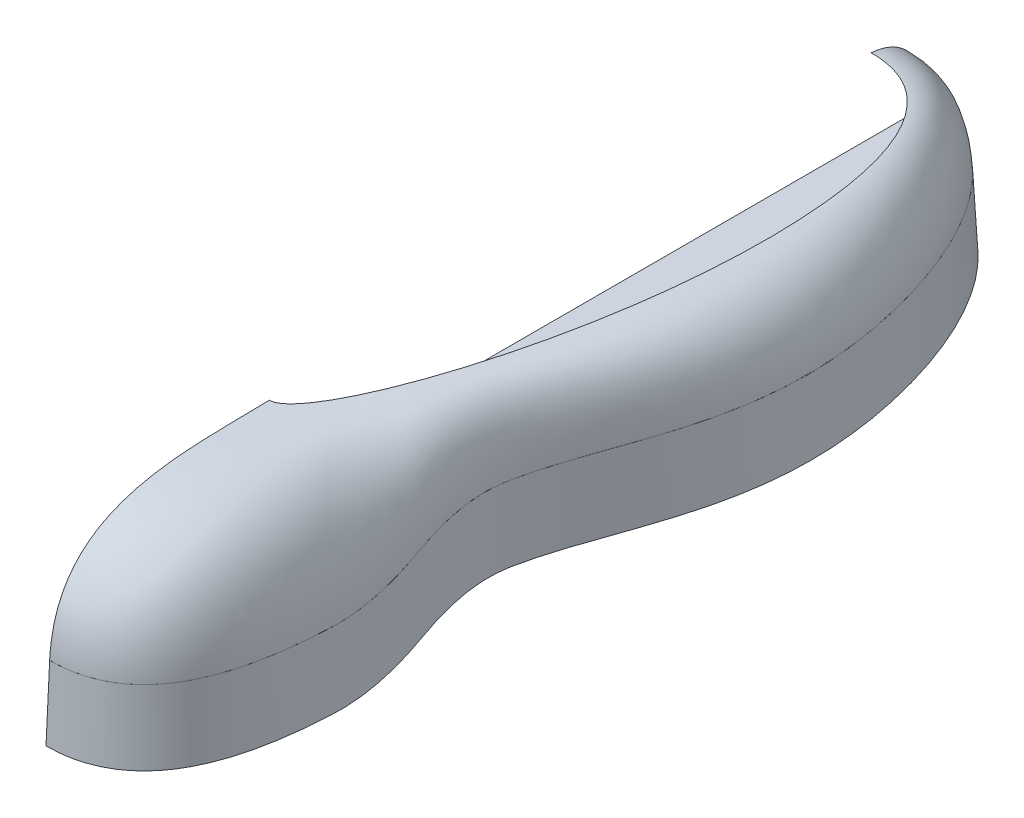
SolidWorks part; units mm, degrees
ref_plane "Front Plane" through (0, 0, 0) normal (0, 0, 1) x (1, 0, 0)
ref_plane "Top Plane" through (0, 0, 0) normal (0, 1, 0) x (1, 0, 0)
ref_plane "Right Plane" through (0, 0, 0) normal (1, 0, 0) x (0, 0, -1)
sketch "Side View Sketch" plane through (0, 0, 0) normal (1, 0, 0) x (0, 0, -1)
  line L0 (-76, 0) -> (70, 0)
  dimension "D1" = 146
  dimension "D2" = 70
sketch "Top View Sketch"
sketch "Side Parting Line" plane through (0, 0, 0) normal (1, 0, 0) x (0, 0, -1)
  line L0 (-76, 0) -> (70, 0) construction
  line L1 (-19, 0) -> (82.163, 0) construction
  line L2 (-48.1033, -7) -> (-94.2513, -7) construction
  arc A0 (-19, 0) -> (-33.5516, -3.5) centre (-19, -32) ccw construction
  arc A1 (-33.5516, -3.5) -> (-48.1033, -7) centre (-48.1033, 25) cw construction
  spline S0 degree 3 poles (-94.2513, -7) (-78.8686, -7) (-63.0665, -7) (-46.8451, -7) (-45.5867, -6.9092) (-44.7519, -6.8268) (-44.3354, -6.7774) (-41.8293, -6.4803) (-39.3757, -5.8901) (-37.0086, -5.0151) (-36.2219, -4.7243) (-34.6713, -4.0809) (-32.432, -2.9191) (-30.8814, -2.2757) (-30.0947, -1.9849) (-27.7276, -1.1099) (-25.2739, -0.5197) (-22.7679, -0.2226) (-22.3514, -0.1732) (-21.5165, -0.0908) (-20.2581, 0) (14.3016, 0) (48.442, 0) (82.163, 0) knots 0 0 0 0 0.260018 0.267107 0.274195 0.281284 0.281284 0.281284 0.323744 0.323744 0.323744 0.337922 0.3521 0.366278 0.366278 0.366278 0.408737 0.408737 0.408737 0.415826 0.422915 0.430004 1 1 1 1 weights 1 1 1 1 1 1 1 0.995363 0.995363 1 1 1 1 1 1 0.995363 0.995363 1 1 1 1 1 1 1
  dimension "D2" = 32
  dimension "D1" = 19
  dimension "D4" = 7
surface "Surface-Extrude1" sketch "Side Parting Line" parameters "D1"=40
sketch "Top Parting Line" plane through (0, 0, 0) normal (0, 1, 0) x (1, 0, 0)
  line L0 (0, -76) -> (0, 70) construction
  line L1 (-12.7688, -76) -> (12.7688, -76) construction
  line L2 (19.3749, 70) -> (-19.3749, 70) construction
  spline S0 degree 3 poles (0, 70) (17.1269, 70) (39.1281, 14.7356) (17.7324, -11.1007) (19.1301, -45.4428) (19.3472, -76) (0, -76) knots 0 0 0 0 0.286163 0.608331 0.679715 1 1 1 1
surface "Surface-Trim1"
other "Ruled Surface1" parameters "D1"=12, "D2"=3
ref_plane "Plane1" through (0, 12.2, 0) normal (0, 1, 0) x (1, 0, 0)
sketch "Keypad Outline" plane through (0, 12.2, 0) normal (0, 1, 0) x (1, 0, 0)
  line L0 (0, -76) -> (0, 70) construction
  line L1 (10.5391, 60.5) -> (-10.5391, 60.5) construction
  line L2 (-9.0822, -39.5) -> (9.0822, -39.5) construction
  spline S0 degree 3 poles (0, 60.5) (13.1738, 60.5) (25.9169, 16.2941) (6.5015, -39.5) (0, -39.5) knots 0 0 0 0 0.330968 1 1 1 1
  dimension "D1" = 9.5
  dimension "D2" = 100
sketch "Loft Profile1" plane through (0, 0, 0) normal (1, 0, 0) x (0, 0, -1)
  line L0 (-76, -7) -> (-76.6276, -18.9836) construction
  line L2 (-39.5, 12.2) -> (-14.6205, 13.0688) construction
  line L3 (60.5, 12.2) -> (-39.5, 12.2) construction
  spline S0 degree 3 poles (-39.5, 12.2) (-53.2389, 11.7202) (-74.9012, 13.9794) (-76, -7) knots 0 0 0 0 1 1 1 1
  dimension "D1" = 2
sketch "Loft Profile2" plane through (0, 0, 0) normal (1, 0, 0) x (0, 0, -1)
  line L0 (70.6279, -11.9836) -> (70, 0) construction
  line L1 (60.5, 12.2) -> (49.2048, 13.1882) construction
  line L2 (60.5, 12.2) -> (-39.5, 12.2) construction
  spline S0 degree 3 poles (60.5, 12.2) (67.6214, 11.577) (69.7303, 5.1471) (70, 0) knots 0 0 0 0 1 1 1 1
  dimension "D1" = 5
ref_plane "Plane2" through (0, 0, 19) normal (0, 0, 1) x (1, 0, 0)
sketch "Loft Profile3" plane through (0, 0, 19) normal (0, 0, 1) x (1, 0, 0)
  line L2 (11.3535, 12.2) -> (-1.2628, 13.3038) construction
  line L3 (19.2761, 0.005) -> (20.118, -16.0584) construction
  line L4 (18.1917, 12.2) -> (0, 12.2) construction
  line L5 (0, -28.3412) -> (0, 28.3412) construction
  spline S0 degree 3 poles (11.3535, 12.2) (16.1825, 11.7775) (18.8721, 7.7152) (19.2761, 0.005) knots 0 0 0 0 1 1 1 1
  dimension "D1" = 5
  dimension "D2" = 3
sketch "Sketch11" plane through (4.7369, 0, 0) normal (0, 0, 1) x (0, 1, 0)
  line L0 (12.2, -11.1545) -> (13.1643, -0.1327) construction
  line L1 (0, -20.4541) -> (-15.5939, -21.2714) construction
  line L2 (0.005, -14.5392) -> (-16.0584, -15.3811) construction
  line L3 (12.2, -6.6165) -> (13.3038, 5.9998) construction
  spline S0 degree 3 poles (12.2, -11.1545) (11.575, -18.2982) (6.3221, -20.1228) (0, -20.4541) knots 0 0 0 0 1 1 1 1
surface "Surface-Loft1"
